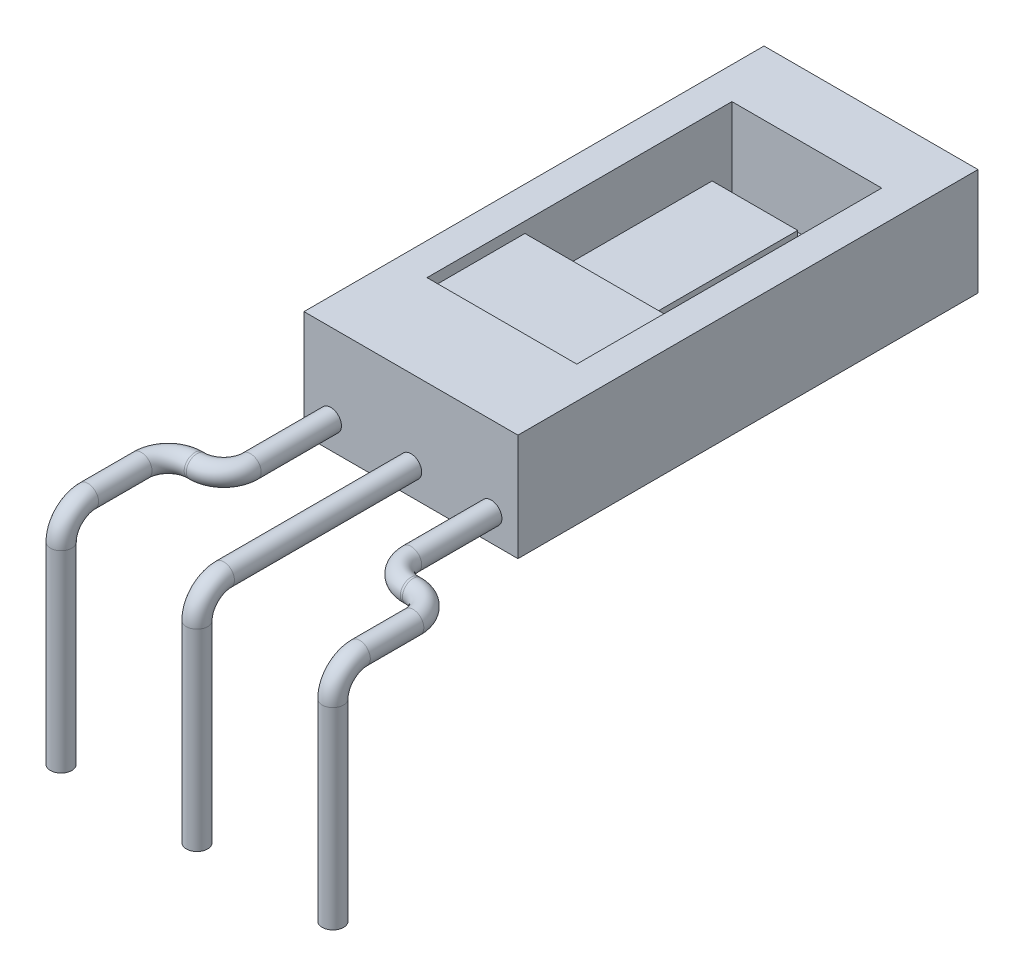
SolidWorks part; units mm, degrees
ref_plane "Plan de face" through (0, 0, 0) normal (0, 0, 1) x (1, 0, 0)
ref_plane "Plan de dessus" through (0, 0, 0) normal (0, 1, 0) x (1, 0, 0)
ref_plane "Plan de droite" through (0, 0, 0) normal (1, 0, 0) x (0, 0, -1)
sketch "Esquisse1" plane through (0, 0, 0) normal (0, 1, 0) x (1, 0, 0)
  line L0 (-6.3491, 0) -> (15.76, 0) construction
  line L1 (2, 11.3549) -> (2, -4.3526) construction
  line L2 (-2, 11.9649) -> (-2, -5.0388) construction
  line L3 (0, -18.8409) -> (0, 14.4626) construction
  line L4 (-6.3491, 8.6) -> (17.6559, 8.6) construction
  line L6 (-2, 8.6) -> (2, 8.6)
  line L7 (-2, 8.6) -> (-2, 0)
  line L8 (-2, 0) -> (2, 0)
  line L9 (2, 8.6) -> (2, 0)
extrude "Extrusion1" add sketch "Esquisse1" along normal blind 2
sketch "Esquisse3" plane through (0, 2, 0) normal (0, 1, 0) x (-1, 0, 0)
  line L0 (2, 0.8724) -> (2, -9.6488) construction
  line L1 (0, -0.411) -> (0, 1.5888) construction
  line L2 (2.4488, -8.6) -> (-2.4014, -8.6) construction
  line L3 (1.4, 0.8724) -> (1.4, -9.6488) construction
  line L4 (2.4488, -1.7) -> (-2.4014, -1.7) construction
  line L5 (2.4488, -7.4) -> (-2.4014, -7.4) construction
  line L6 (-2, 0.8724) -> (-2, -9.6488) construction
  line L7 (-1.4, 0.7381) -> (-1.4, -9.231) construction
  line L9 (1.4, -7.4) -> (-1.4, -7.4)
  line L10 (1.4, -7.4) -> (1.4, -1.7)
  line L11 (1.4, -1.7) -> (-1.4, -1.7)
  line L12 (-1.4, -7.4) -> (-1.4, -1.7)
  dimension "D1" = 0.6
  dimension "D2" = 0.6
  dimension "D3" = 1.2
extrude "Enlèv. mat.-Extru.1" cut sketch "Esquisse3" against normal blind 1.5
sketch "Esquisse4" plane through (0, 0.5, 0) normal (0, 1, 0) x (-1, 0, 0)
  line L0 (3.1801, -1.7) -> (-2.7745, -1.7) construction
  line L1 (-2.7745, -3.53) -> (3.1801, -3.53) construction
  line L3 (1.4, -3.53) -> (-1.4015, -3.53)
  line L4 (1.4, -3.53) -> (1.4, -1.7)
  line L5 (1.4, -1.7) -> (-1.4015, -1.7)
  line L6 (-1.4015, -3.53) -> (-1.4015, -1.7)
  dimension "D1" = 1.83
extrude "Extrusion2" add sketch "Esquisse4" along normal blind 1.3
sketch "Esquisse5" plane through (0, 0.5, 0) normal (0, 1, 0) x (-1, 0, 0)
  line L0 (0, -0.3513) -> (0, -9.0071) construction
  line L1 (-1.7312, -3.53) -> (1.92, -3.53) construction
  line L2 (1.7505, -6.43) -> (-3.3087, -6.43) construction
  line L3 (0.8, -6.873) -> (0.8, -3.0824) construction
  line L4 (-0.8, -6.873) -> (-0.8, -3.0824) construction
  line L6 (0.8, -6.43) -> (-0.8, -6.43)
  line L7 (0.8, -6.43) -> (0.8, -3.53)
  line L8 (0.8, -3.53) -> (-0.8, -3.53)
  line L9 (-0.8, -6.43) -> (-0.8, -3.53)
  dimension "D1" = 2.9
  dimension "D2" = 0.8
  dimension "D3" = 1.6
extrude "Extrusion3" add sketch "Esquisse5" along normal blind 1
sketch "Esquisse6" plane through (0, 0, 0) normal (0, 0, 1) x (1, 0, 0)
  line L0 (0, -0.3461) -> (0, 2.393) construction
  line L1 (-2.4999, 0.5) -> (2.65, 0.5) construction
  circle A0 centre (0, 0.5) radius 0.2
sketch "Esquisse7" plane through (0, 0, 0) normal (1, 0, 0) x (0, 0, -1)
  line L0 (-1.2715, 0) -> (9.5017, 0) construction
  line L1 (-1.2715, -2) -> (9.5017, -2) construction
  line L2 (9.5017, -3.6) -> (-15.0655, -3.6) construction
  line L3 (-7.5586, 0.5) -> (2.1838, 0.5) construction
  line L4 (-4, 1.3427) -> (-4, -4.4933) construction
  line L5 (0, 3.1312) -> (0, -0.9634) construction
  line L6 (0, 0.5) -> (-3.5, 0.5)
  line L7 (-4, 0) -> (-4, -3.6)
  arc A0 (-3.5, 0.5) -> (-4, 0) centre (-3.5, 0) ccw
  dimension "D5" = 0.5
  dimension "D1" = 0.5
  dimension "D2" = 2
  dimension "D3" = 1.6
  dimension "D4" = 4
sweep "Balayage1" add profiles "Esquisse6" path "Esquisse7"
sketch "Esquisse8" plane through (0, 0, 0) normal (0, 0, 1) x (1, 0, 0)
  line L0 (-3.1689, 0) -> (2.5906, 0) construction
  line L1 (2.5906, 0.5) -> (-3.1689, 0.5) construction
  line L2 (0, 2.5696) -> (0, -0.6643) construction
  line L3 (-1.5, 2.5696) -> (-1.5, -0.5581) construction
  circle A0 centre (-1.5, 0.5) radius 0.2
  dimension "D1" = 0.5
  dimension "D2" = 1.5
ref_plane "Plan1" through (0, 0.5, 0) normal (0, 1, 0) x (-1, 0, 0)
sketch "Esquisse10" plane through (0, 0.5, 0) normal (0, 1, 0) x (-1, 0, 0)
  line L0 (0, -1.0237) -> (0, 4.609) construction
  line L1 (1.5, -1.0237) -> (1.5, 4.609) construction
  line L2 (2.8116, 2) -> (0.8473, 2) construction
  line L3 (2.54, 0.9169) -> (2.54, 4.609) construction
  line L4 (2.9252, 4) -> (-2.1408, 4) construction
  line L5 (3.1689, 0) -> (-2.5906, 0) construction
  dimension "D1" = 4
  dimension "D2" = 2
  dimension "D3" = 1.5
  dimension "D4" = 2.54
sketch3d "Esquisse3D3"
  line L1 (-1.5, 0.5, 0) -> (-1.5, 0.5, 1.5)
  line L2 (-2, 0.5, 2) -> (-2.04, 0.5, 2)
  line L3 (-2.54, 0.5, 2.5) -> (-2.54, 0.5, 3.5)
  line L4 (-2.54, 0, 4) -> (-2.54, -3.6, 4)
  arc A0 (-2.54, 0.5, 3.5) -> (-2.54, 0, 4) centre (-2.54, 0, 3.5) ccw
  arc A1 (-2.04, 0.5, 2) -> (-2.54, 0.5, 2.5) centre (-2.04, 0.5, 2.5) ccw
  arc A2 (-1.5, 0.5, 1.5) -> (-2, 0.5, 2) centre (-2, 0.5, 1.5) ccw
  point P5 (0, 0, 0)
  point P8 (-2.54, 0.5, 4)
  point P9 (-2.04, 0, 3.5)
  point P12 (-2.54, 0.5, 2)
  point P13 (-2.04, 1, 2.5)
  point P16 (-1.5, 0.5, 2)
  point P17 (-2, 0, 1.5)
  dimension "D1" = 0.5
  dimension "D2" = 0.5
  dimension "D3" = 0.5
sweep "Balayage2" add profiles "Esquisse8" path "Esquisse3D3"
ref_plane "Plan2" through (0, 0, 0) normal (1, 0, 0) x (0, 0, -1)
mirror "Symétrie1" about plane through (0, 0, 0) normal (1, 0, 0) of "Balayage2"
